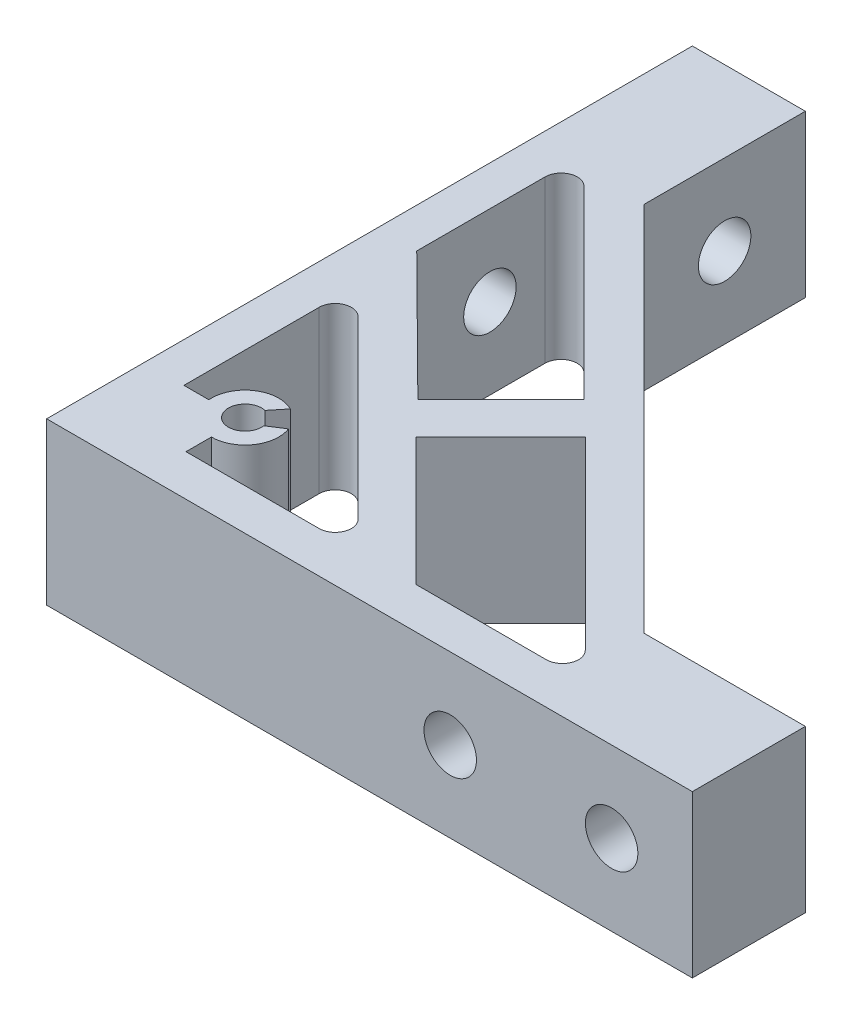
SolidWorks part; units mm, degrees
ref_plane "前视基准面" through (0, 0, 0) normal (0, 0, 1) x (1, 0, 0)
ref_plane "上视基准面" through (0, 0, 0) normal (0, 1, 0) x (1, 0, 0)
ref_plane "右视基准面" through (0, 0, 0) normal (1, 0, 0) x (0, 0, -1)
other "Configuration Table"
sketch "草图1" plane through (0, 0, 0) normal (0, 1, 0) x (1, 0, 0)
  line L0 (0, 80) -> (0, 0)
  line L1 (0, 0) -> (80, 0)
  line L2 (80, 0) -> (80, 14)
  line L3 (80, 14) -> (60, 14)
  line L4 (60, 14) -> (14, 60)
  line L5 (14, 60) -> (14, 80)
  line L6 (14, 80) -> (0, 80)
  dimension "D1" = 80
  dimension "D2" = 80
  dimension "D3" = 14
  dimension "D4" = 14
  dimension "D5" = 20
  dimension "D6" = 20
extrude "凸台-拉伸1" add sketch "草图1" along normal blind 20
sketch "草图2" plane through (0, 0, 0) normal (-1, 0, 0) x (0, 0, 1)
  line L0 (0, 10) -> (-80, 10) construction
  line L1 (0, 20) -> (0, 0) construction
  line L2 (-80, 20) -> (-80, 0) construction
  circle A0 centre (-70, 10) radius 3.25
  circle A1 centre (-50, 10) radius 3.25
  dimension "D1" = 6.5
  dimension "D2" = 6.5
  dimension "D3" = 10
  dimension "D4" = 20
extrude "切除-拉伸1" cut sketch "草图2" against normal through all
sketch "草图3" plane through (0, 0, 0) normal (0, 0, 1) x (1, 0, 0)
  line L0 (80, 10) -> (0, 10) construction
  line L1 (80, 20) -> (80, 0) construction
  line L2 (0, 20) -> (0, 0) construction
  circle A0 centre (70, 10) radius 3.25
  circle A1 centre (50, 10) radius 3.25
  dimension "D1" = 6.5
  dimension "D2" = 6.5
  dimension "D3" = 10
  dimension "D4" = 20
extrude "切除-拉伸2" cut sketch "草图3" against normal through all
sketch "草图4" plane through (0, 0, 0) normal (0, -1, 0) x (1, 0, 0)
  line L0 (133.1667, 332) -> (665.8333, 332) construction
  line L1 (133.1667, 332) -> (665.8333, 332) construction
  line L2 (133.1667, 332) -> (665.8333, 332) construction
  line L3 (147.2993, -334.3096) -> (645.2993, -334.3096) construction
  line L4 (468.6171, -295.6378) -> (817.2837, -295.6378) construction
  line L5 (79.5, 158.8321) -> (397.5, 158.8321) construction
  line L6 (20.9011, -25.0904) -> (31.1919, -35.3812)
  line L7 (31.1919, -35.3812) -> (8.3308, -58.2424)
  line L8 (4.9166, -56.8282) -> (4.9166, -40.9349)
  line L9 (4.9166, -40.9349) -> (20.9011, -25.0904)
  line L10 (24.8379, -20.9303) -> (35.319, -31.4114)
  line L11 (35.319, -31.4114) -> (58.2108, -8.5196)
  line L12 (56.7966, -5.1054) -> (40.6628, -5.1054)
  line L13 (40.6628, -5.1054) -> (24.8379, -20.9303)
  line L14 (12.1608, -5.1054) -> (28.6514, -5.1054)
  line L15 (30.0656, -8.5196) -> (8.3308, -30.2544)
  line L16 (4.9166, -28.8402) -> (4.9166, -12.0905)
  line L17 (4.9166, -12.0905) -> (8.0005, -12.0905)
  line L18 (12.1608, -5.1054) -> (12.1608, -8.2492)
  line L19 (12.6255, -14.4303) -> (14.0301, -16.1542)
  line L20 (16.0655, -13.8965) -> (14.2027, -12.7004)
  arc A0 (58.2108, -8.5196) -> (56.7966, -5.1054) centre (56.7966, -7.1054) ccw
  arc A1 (8.3308, -58.2424) -> (4.9166, -56.8282) centre (6.9166, -56.8282) cw
  arc A2 (8.0005, -12.0905) -> (14.0301, -16.1542) centre (12.1608, -12.4227) ccw
  arc A3 (14.2027, -12.7004) -> (12.6255, -14.4303) centre (12.1608, -12.4227) ccw
  arc A4 (16.0655, -13.8965) -> (12.1608, -8.2492) centre (12.1608, -12.4227) ccw
  arc A5 (8.3308, -30.2544) -> (4.9166, -28.8402) centre (6.9166, -28.8402) cw
  arc A6 (28.6514, -5.1054) -> (30.0656, -8.5196) centre (28.6514, -7.1054) cw
  dimension "D1" = 2
  dimension "D2" = 2
extrude "切除-拉伸3" cut sketch "草图4" against normal through all
ref_plane "基准面1" through (0, 0, -35) normal (0, 0, 1) x (1, 0, 0)
ref_plane "基准面2" through (35, 0, 0) normal (1, 0, 0) x (0, 0, -1)
sketch "草图7" plane through (0, 0, -35) normal (0, 0, 1) x (1, 0, 0)
  circle A0 centre (50, 10) radius 5.5
  dimension "D1" = 11
extrude "切除-拉伸4" cut sketch "草图7" along normal blind 25
sketch "草图8" plane through (35, 0, 0) normal (1, 0, 0) x (0, 0, -1)
  circle A0 centre (50, 10) radius 5.5
  dimension "D1" = 11
extrude "切除-拉伸5" cut sketch "草图8" against normal blind 25
